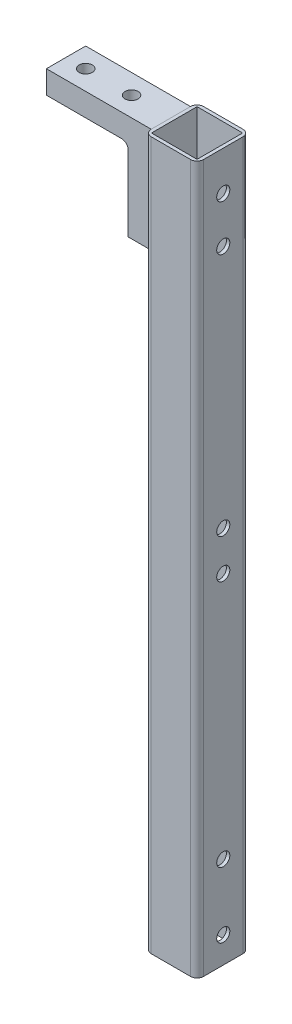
SolidWorks part; units mm, degrees
ref_plane "Front Plane" through (0, 0, 0) normal (0, 0, 1) x (1, 0, 0)
ref_plane "Top Plane" through (0, 0, 0) normal (0, 1, 0) x (1, 0, 0)
ref_plane "Right Plane" through (0, 0, 0) normal (1, 0, 0) x (0, 0, -1)
sketch "Sketch1" plane through (0, 0, 0) normal (0, 0, 1) x (1, 0, 0)
  line L0 (0, 0) -> (25.4, 0)
  line L1 (25.4, 0) -> (25.4, -342.9)
  line L2 (25.4, -342.9) -> (0, -342.9)
  line L3 (0, -342.9) -> (0, 0)
  line L4 (0, 0) -> (-50.8, 0)
  line L5 (-50.8, 0) -> (-50.8, -11.1252)
  line L6 (-50.8, -11.1252) -> (-11.1252, -11.1252)
  line L7 (-11.1252, -11.1252) -> (-11.1252, -50.8)
  line L8 (-11.1252, -50.8) -> (0, -50.8)
  line L9 (-41.275, 0) -> (-41.275, -11.1252)
  line L10 (-19.05, 0) -> (-19.05, -11.1252)
  line L11 (-11.1252, -41.275) -> (0, -41.275)
  line L12 (-11.1252, -19.05) -> (0, -19.05)
  dimension "D1" = 342.9
  dimension "D2" = 25.4
  dimension "D3" = 11.1252
  dimension "D4" = 11.1252
  dimension "D5" = 50.8
  dimension "D6" = 9.525
  dimension "D7" = 22.225
  dimension "D8" = 9.525
  dimension "D9" = 22.225
  dimension "D10" = 50.8
sketch "Sketch2" plane through (0, 0, 0) normal (0, 0, 1) x (1, 0, 0)
  line L0 (0, 0) -> (25.4, 0) construction
  line L1 (0, -342.9) -> (0, 0) construction
  line L2 (25.4, 0) -> (25.4, -342.9) construction
  line L3 (25.4, -342.9) -> (0, -342.9) construction
  line L4 (0, 0) -> (25.4, 0)
  line L5 (0, -342.9) -> (0, 0)
  line L6 (25.4, 0) -> (25.4, -342.9)
  line L7 (25.4, -342.9) -> (0, -342.9)
extrude "Boss-Extrude1" add sketch "Sketch2" along normal mid plane 25.4
shell "Shell1" thickness 1.651
fillet "Fillet1" radius 3.175 4 edges at (25.4, -171.45, -12.7) (0, -171.45, -12.7) (0, -171.45, 12.7) (25.4, -171.45, 12.7)
sketch "Sketch3" plane through (0, 0, 0) normal (0, 0, 1) x (1, 0, 0)
  line L0 (0, -342.9) -> (0, 0) construction
  line L1 (-11.1252, -50.8) -> (0, -50.8) construction
  line L2 (-11.1252, -11.1252) -> (-11.1252, -50.8) construction
  line L3 (-50.8, -11.1252) -> (-11.1252, -11.1252) construction
  line L4 (-50.8, 0) -> (-50.8, -11.1252) construction
  line L5 (0, 0) -> (-50.8, 0) construction
  line L6 (0, -50.8) -> (0, 0)
  line L7 (-11.1252, -50.8) -> (0, -50.8)
  line L8 (-11.1252, -11.1252) -> (-11.1252, -50.8)
  line L9 (-50.8, -11.1252) -> (-11.1252, -11.1252)
  line L10 (-50.8, 0) -> (-50.8, -11.1252)
  line L11 (0, 0) -> (-50.8, 0)
extrude "Boss-Extrude2" add sketch "Sketch3" along normal mid plane 19.05 separate body
fillet "Fillet2" radius 3.175 1 edges at (-11.1252, -11.1252, 0)
hole_wizard "1/4 (0.25) Diameter Hole1" positions "Sketch5" profile "Sketch4" hole size "1/4" standard "ANSI Inch"
sketch "Sketch5" plane through (-11.1252, 0, 0) normal (-1, 0, 0) x (0, 0, 1)
  point P0 (0, -19.05)
  point P3 (0, -41.275)
sketch "Sketch4" plane through (-11.1252, -19.05, 0) normal (0, 1, 0) x (0, 0, 1)
  line L0 (0, 0) -> (0, 20.9577)
  line L1 (0, 20.9577) -> (3.175, 19.05)
  line L2 (3.175, 19.05) -> (3.175, 0)
  line L5 (3.175, 0) -> (0, 0)
  line L10 (0, 20.9577) -> (-3.175, 19.05) construction
  line L11 (0, -6.35) -> (0, 107.95) construction
  dimension "Hole Dia." = 6.35
  dimension "Hole Depth" = 19.05
  dimension "Drill Angle" = 118
hole_wizard "1/4 (0.25) Diameter Hole2" positions "Sketch7" profile "Sketch6" hole size "1/4" standard "ANSI Inch"
sketch "Sketch7" plane through (0, -11.1252, 0) normal (0, -1, 0) x (-1, 0, 0)
  point P0 (41.275, 0)
  point P3 (19.05, 0)
sketch "Sketch6" plane through (-41.275, -11.1252, 0) normal (1, 0, 0) x (0, 0, -1)
  line L0 (0, 0) -> (0, 20.9577)
  line L1 (0, 20.9577) -> (3.175, 19.05)
  line L2 (3.175, 19.05) -> (3.175, 0)
  line L5 (3.175, 0) -> (0, 0)
  line L10 (0, 20.9577) -> (-3.175, 19.05) construction
  line L11 (0, -6.35) -> (0, 107.95) construction
  dimension "Hole Dia." = 6.35
  dimension "Hole Depth" = 19.05
  dimension "Drill Angle" = 118
sketch "Sketch8" plane through (-11.1252, 0, 0) normal (-1, 0, 0) x (0, 0, 1)
  circle A0 centre (0, -41.275) radius 3.175 construction
  circle A1 centre (0, -19.05) radius 3.175 construction
  circle A2 centre (0, -41.275) radius 3.175
  circle A3 centre (0, -19.05) radius 3.175
extrude "Cut-Extrude1" cut sketch "Sketch8" against normal blind 53.34
sketch "Sketch9" plane through (0, 0, 0) normal (1, 0, 0) x (0, 0, -1)
  circle A0 centre (0, -159.5374) radius 3.175
  circle A1 centre (0, -178.5874) radius 3.175
  dimension "D1" = 6.35
  dimension "D2" = 159.5374
  dimension "D3" = 19.05
extrude "Cut-Extrude2" cut sketch "Sketch9" along normal blind 38.1
sketch "Sketch10" plane through (0, 0, 0) normal (1, 0, 0) x (0, 0, -1)
  line L0 (-9.525, -342.9) -> (9.525, -342.9) construction
  circle A0 centre (0, -298.45) radius 3.175
  circle A1 centre (0, -330.2) radius 3.175
  dimension "D1" = 6.35
  dimension "D2" = 12.7
  dimension "D3" = 31.75
extrude "Cut-Extrude3" cut sketch "Sketch10" along normal blind 50.8
